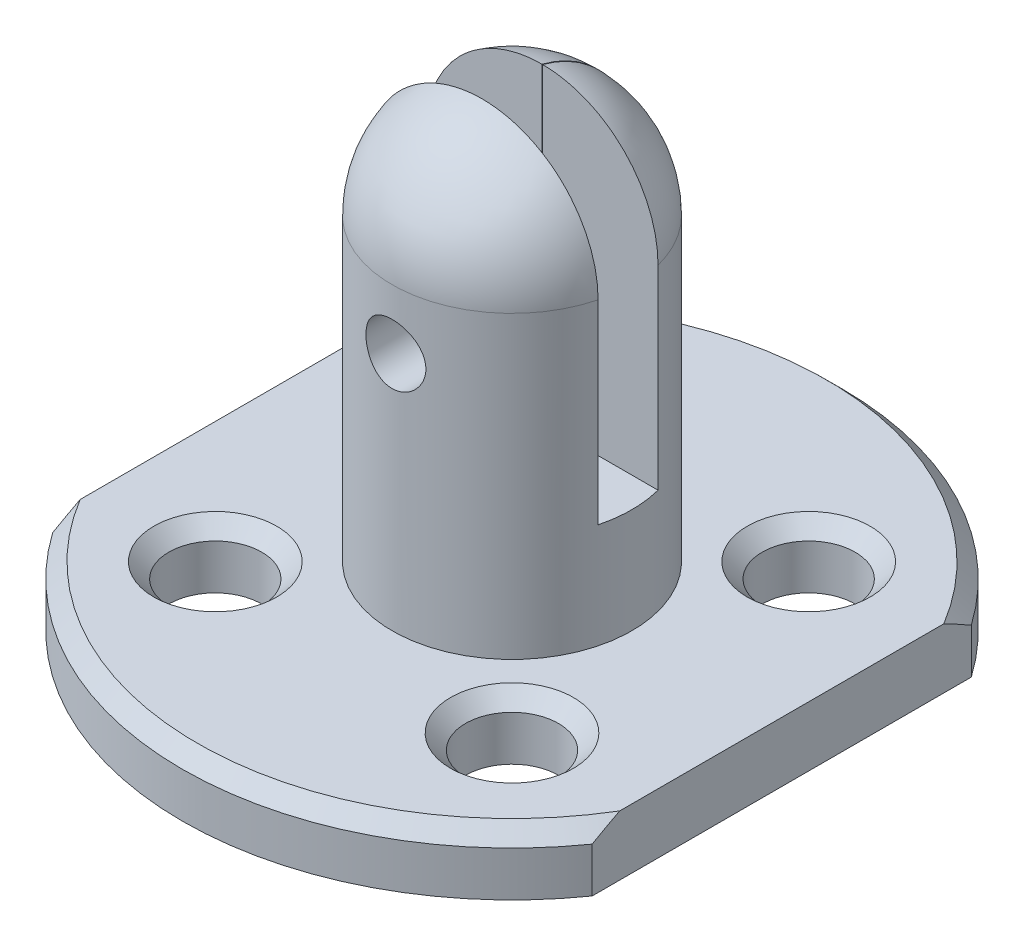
SolidWorks part; units mm, degrees
ref_plane "Front Plane" through (0, 0, 0) normal (0, 0, 1) x (1, 0, 0)
ref_plane "Top Plane" through (0, 0, 0) normal (0, 1, 0) x (1, 0, 0)
ref_plane "Right Plane" through (0, 0, 0) normal (1, 0, 0) x (0, 0, -1)
sketch "Sketch1" plane through (0, 0, 0) normal (0, 1, 0) x (1, 0, 0)
  circle A0 centre (0, 0) radius 11
  dimension "D1" = 22
extrude "Boss-Extrude1" add sketch "Sketch1" along normal blind 2
sketch "Sketch2" plane through (0, 2, 0) normal (0, 1, 0) x (1, 0, 0)
  line L0 (9, 0) -> (-9, 0)
  line L1 (-9, -6.3246) -> (-9, 6.3246)
  line L2 (9, -6.3246) -> (9, 6.3246)
  circle A0 centre (0, 0) radius 11 construction
  arc A1 (-9, 6.3246) -> (-9, -6.3246) centre (0, 0) ccw
  arc A2 (9, -6.3246) -> (9, 6.3246) centre (0, 0) ccw
  point P4 (0, 0)
  point P9 (-9, 0)
  point P11 (9, 0)
  dimension "D1" = 18
extrude "Cut-Extrude1" cut sketch "Sketch2" against normal through all contours L2 M4 | L1 M4
sketch "Sketch6" plane through (0, 0, 0) normal (0, -1, 0) x (1, 0, 0)
  circle A0 centre (0, 0) radius 3
  dimension "D1" = 6
extrude "Boss-Extrude3" add sketch "Sketch6" along normal blind 1
sketch "Sketch13" plane through (0, 2, 0) normal (0, 1, 0) x (1, 0, 0)
  line L0 (0, 0) -> (4.9497, 4.9497) construction
  line L1 (0, 0) -> (0, 7) construction
  circle A0 centre (0, 0) radius 7 construction
  circle A1 centre (4.9497, 4.9497) radius 1.55
  circle A2 centre (4.9497, -4.9497) radius 1.55
  circle A3 centre (-4.9497, -4.9497) radius 1.55
  circle A4 centre (-4.9497, 4.9497) radius 1.55
  point P15 (0, 0)
  dimension "D1" = 14
  dimension "D3" = 3.1
  dimension "D2" = 45
  dimension "D4" = 4
extrude "Cut-Extrude10" cut sketch "Sketch13" against normal through all
chamfer "Chamfer1" distance 0.5 angle 45 4 edges at (-4.9497, 2, 6.4997) (4.9497, 2, 6.4997) (4.9497, 2, -3.3997) (-4.9497, 2, -3.3997)
chamfer "Chamfer3" distance 0.5 angle 45 2 edges at (0, 2, 11) (0, 2, -11)
sketch "Sketch15" plane through (0, 0, 0) normal (1, 0, 0) x (0, 0, -1)
  line L0 (0, 2) -> (0, 16)
  line L1 (-5.4083, 2) -> (5.4083, 2) construction
  line L2 (4, 12) -> (4, 2)
  line L3 (0, 2) -> (4, 2)
  arc A0 (0, 16) -> (4, 12) centre (0, 12) cw
  dimension "D1" = 14
  dimension "D2" = 4
  dimension "D3" = 10
revolve "Revolve1" add sketch "Sketch15" angle 359 about L0
sketch "Sketch17" plane through (0, 0, 0) normal (1, 0, 0) x (0, 0, -1)
  line L0 (-5.4083, 2) -> (5.4083, 2) construction
  line L1 (1, 5.5) -> (-1, 5.5)
  line L2 (1, 5.5) -> (1, 16.4573)
  line L3 (1, 16.4573) -> (-1, 16.4573)
  line L4 (-1, 5.5) -> (-1, 16.4573)
  line L5 (1, 5.5) -> (-1, 16.4573) construction
  line L6 (1, 16.4573) -> (-1, 5.5) construction
  point P0 (0, 10.9787)
  point P5 (0, 12.9397)
  point P8 (0, 0)
  dimension "D1" = 3.5
  dimension "D2" = 2
extrude "Cut-Extrude11" cut sketch "Sketch17" against normal mid plane 10
sketch "Sketch18" plane through (0, 0, 0) normal (0, 0, 1) x (1, 0, 0)
  line L0 (9, 2) -> (-9, 2) construction
  circle A0 centre (0, 10) radius 1
  point P4 (0, 0)
  dimension "D1" = 2
  dimension "D2" = 8
extrude "Cut-Extrude12" cut sketch "Sketch18" against normal mid plane 10
